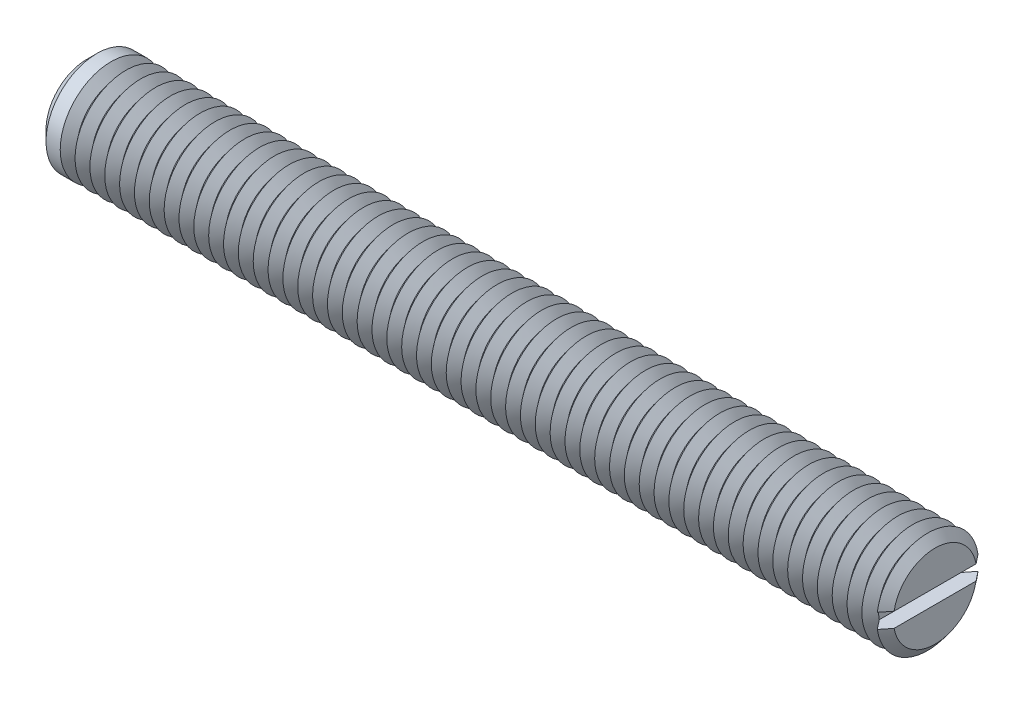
SolidWorks part; units mm, degrees
ref_plane "Front Plane" through (0, 0, 0) normal (0, 0, 1) x (1, 0, 0)
ref_plane "Top Plane" through (0, 0, 0) normal (0, 1, 0) x (1, 0, 0)
ref_plane "Right Plane" through (0, 0, 0) normal (1, 0, 0) x (0, 0, -1)
sketch "Sketch1" plane through (0, 0, 0) normal (1, 0, 0) x (0, 0, -1)
  circle A0 centre (0, 0) radius 6
  dimension "D1" = 12
extrude "Extrude1" add sketch "Sketch1" along normal mid plane 100
sketch "Sketch2" plane through (0, 0, 0) normal (0, 0, 1) x (1, 0, 0)
  line L0 (50, 0.875) -> (48.25, 0.875)
  line L1 (50, -6) -> (50, 6) construction
  line L2 (48.25, 0.875) -> (48.25, -0.875)
  line L3 (0, 0) -> (50000, 0) construction
  line L4 (50, -0.875) -> (48.25, -0.875)
  line L5 (50, -0.875) -> (50, 0.875)
  point P9 (48.25, 0)
  dimension "D1" = 1.75
extrude "Extrude2" cut sketch "Sketch2" against normal mid plane 18
chamfer "Chamfer1" distance 1.2 angle 45 1 edges at (-50, 0, -6)
sketch "Sketch3" plane through (0, 0, 0) normal (0, 0, 1) x (1, 0, 0)
  line L0 (0, 0) -> (30.9602, 0) construction
  line L1 (49.125, -6) -> (50.875, -6)
  line L2 (-48.8, -6) -> (50, -6) construction
  line L3 (50.875, -6) -> (50, -4.9071)
  line L4 (50, -6) -> (50, -0.875) construction
  line L5 (50, -4.9071) -> (49.125, -6)
  dimension "D1" = 1.75
  dimension "D2" = 1.4
revolve "Cut-Revolve1" cut sketch "Sketch3" angle 360 about L0
pattern_linear "LPattern1" count 56 spacing 1.75 along (-1, 0, 0) of "Cut-Revolve1"
equation "\"D2@Sketch3\" = \"D1@Sketch3\"*0.8"
